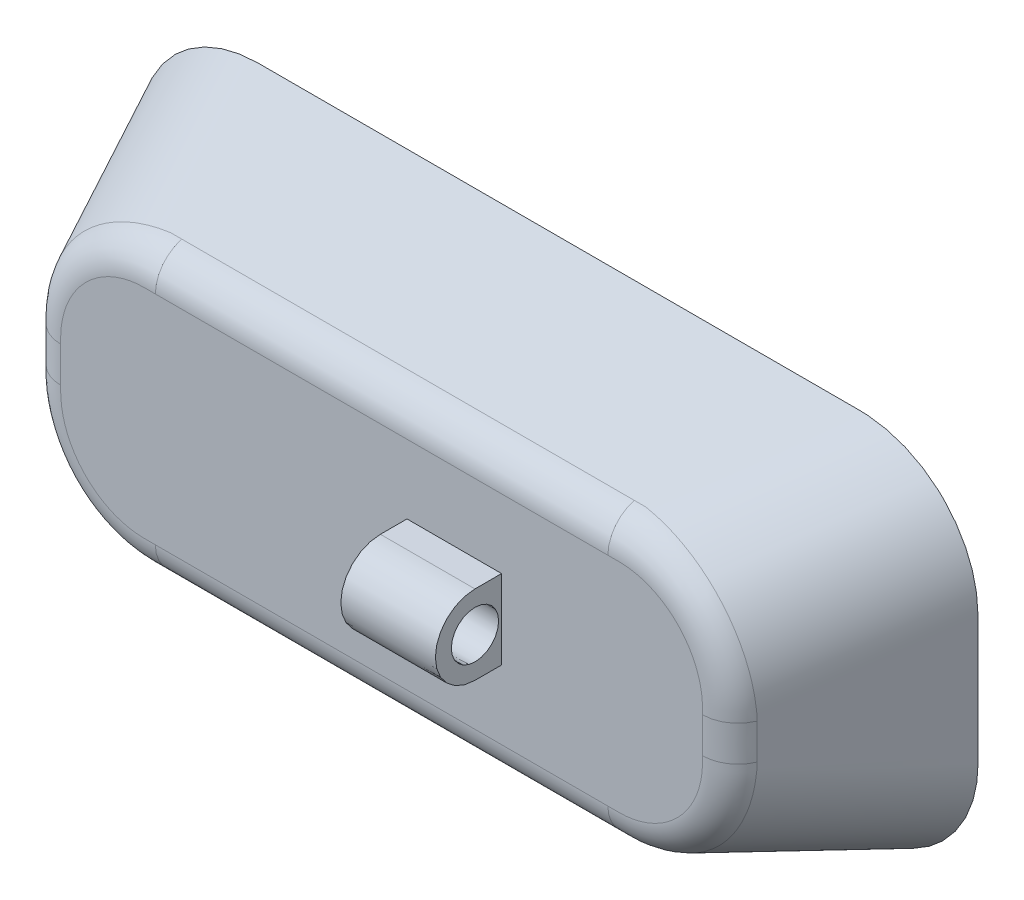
SolidWorks part; units mm, degrees
ref_plane "Front Plane" through (0, 0, 0) normal (0, 0, 1) x (1, 0, 0)
ref_plane "Top Plane" through (0, 0, 0) normal (0, 1, 0) x (1, 0, 0)
ref_plane "Right Plane" through (0, 0, 0) normal (1, 0, 0) x (0, 0, -1)
sketch "Sketch1" plane through (0, 0, 0) normal (0, 0, 1) x (1, 0, 0)
  line L1 (-25.45, 15.45) -> (25.45, 15.45)
  line L2 (-35.45, 5.45) -> (-35.45, -5.45)
  line L3 (-25.45, -15.45) -> (25.45, -15.45)
  line L4 (35.45, 5.45) -> (35.45, -5.45)
  line L5 (-35.45, 15.45) -> (35.45, -15.45) construction
  line L6 (-35.45, -15.45) -> (35.45, 15.45) construction
  arc A0 (-35.45, -5.45) -> (-25.45, -15.45) centre (-25.45, -5.45) ccw
  arc A1 (25.45, -15.45) -> (35.45, -5.45) centre (25.45, -5.45) ccw
  arc A2 (35.45, 5.45) -> (25.45, 15.45) centre (25.45, 5.45) ccw
  arc A3 (-25.45, 15.45) -> (-35.45, 5.45) centre (-25.45, 5.45) ccw
  point P0 (0, 0)
  dimension "D3" = 10
  dimension "D1" = 70.9
  dimension "D2" = 30.9
ref_plane "Plane1" through (0, 0, 15) normal (0, 0, 1) x (1, 0, 0)
sketch "Sketch2" plane through (0, 0, 15) normal (0, 0, 1) x (1, 0, 0)
  line L1 (19.14, 11.5) -> (-19.14, 11.5)
  line L2 (29.14, 1.5) -> (29.14, -1.5)
  line L3 (19.14, -11.5) -> (-19.14, -11.5)
  line L4 (-29.14, 1.5) -> (-29.14, -1.5)
  line L5 (29.14, 11.5) -> (-29.14, -11.5) construction
  line L6 (29.14, -11.5) -> (-29.14, 11.5) construction
  arc A0 (-19.14, 11.5) -> (-29.14, 1.5) centre (-19.14, 1.5) ccw
  arc A1 (-29.14, -1.5) -> (-19.14, -11.5) centre (-19.14, -1.5) ccw
  arc A2 (19.14, -11.5) -> (29.14, -1.5) centre (19.14, -1.5) ccw
  arc A3 (29.14, 1.5) -> (19.14, 11.5) centre (19.14, 1.5) ccw
  point P0 (0, 0)
  dimension "D3" = 10
  dimension "D1" = 23
  dimension "D2" = 58.28
sketch "Sketch3" plane through (0, 0, 0) normal (0, 1, 0) x (1, 0, 0)
  line L0 (0, 0) -> (0, -15) construction
loft "Loft1" add profiles "Sketch1", "Sketch2"
fillet "Fillet1" radius 3 8 edges
shell "Shell1" thickness 3
sketch "Sketch4" plane through (0, 0, 15) normal (0, 0, 1) x (1, 0, 0)
  line L0 (27.1474, -1.5) -> (27.1474, 1.5) construction
  line L1 (2.1474, 3.35) -> (10.1474, 3.35)
  line L2 (2.1474, 3.35) -> (2.1474, -3.35)
  line L3 (2.1474, -3.35) -> (10.1474, -3.35)
  line L4 (10.1474, 3.35) -> (10.1474, -3.35)
  line L5 (2.1474, 3.35) -> (10.1474, -3.35) construction
  line L6 (2.1474, -3.35) -> (10.1474, 3.35) construction
  point P0 (6.1474, 0)
  dimension "D1" = 8
  dimension "D2" = 6.7
  dimension "D3" = 21
extrude "Boss-Extrude1" add sketch "Sketch4" along normal blind 5.6
sketch "Sketch5" plane through (10.1474, 0, 0) normal (1, 0, 0) x (0, 0, -1)
  line L0 (-20.6, -3.35) -> (-20.6, 3.35) construction
  line L1 (-20.6, 3.35) -> (-15, 3.35) construction
  line L2 (-20.6, -3.35) -> (-15, -3.35) construction
  line L3 (-20.6, 3.35) -> (-17.25, 3.35)
  line L4 (-20.6, -3.35) -> (-20.6, 3.35)
  line L5 (-20.6, -3.35) -> (-17.25, -3.35)
  arc A0 (-17.25, 3.35) -> (-17.25, -3.35) centre (-17.25, 0) ccw
extrude "Cut-Extrude1" cut sketch "Sketch5" against normal through all contours A0 M2 M3 | A0 L4 M4
sketch "Sketch6" plane through (10.1474, 0, 0) normal (1, 0, 0) x (0, 0, -1)
  circle A0 centre (-17.25, 0) radius 2
  dimension "D1" = 4
extrude "Cut-Extrude2" cut sketch "Sketch6" against normal through all
